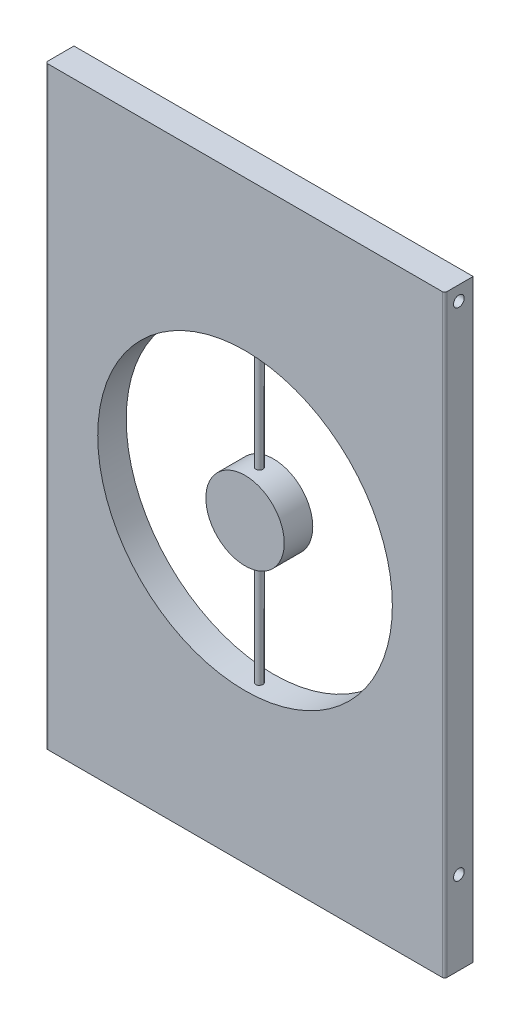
SolidWorks part; units mm, degrees
ref_plane "Front Plane" through (0, 0, 0) normal (0, 0, 1) x (1, 0, 0)
ref_plane "Top Plane" through (0, 0, 0) normal (0, 1, 0) x (1, 0, 0)
ref_plane "Right Plane" through (0, 0, 0) normal (1, 0, 0) x (0, 0, -1)
body saved out of another part "Stock-Donut Shop-1"
hole_wizard "CBORE for M4 Pan Head Machine Screw3" positions "Sketch4" profile "Sketch5" counterbore size "M4" standard "ANSI Metric"
sketch "Sketch4" plane through (48, 0, 0) normal (-1, 0, 0) x (0, 0, 1)
  point P0 (-81, 256)
  point P3 (99, 256)
sketch "Sketch5" plane through (48, 256, -81) normal (0, 1, 0) x (0, 0, 1)
  line L0 (0, 0) -> (0, 30)
  line L1 (0, 30) -> (2.25, 28.6481)
  line L2 (2.25, 28.6481) -> (2.25, 3.1)
  line L3 (2.25, 3.1) -> (4.5, 3.1)
  line L4 (4.5, 3.1) -> (4.5, 0)
  line L5 (4.5, 0) -> (0, 0)
  line L6 (0, 30) -> (-2.25, 28.6481) construction
  line L7 (0, -6.35) -> (0, 107.95) construction
  dimension "Hole Dia." = 4.5
  dimension "Hole Depth" = 30
  dimension "C'Bore Dia." = 9
  dimension "C'Bore Depth" = 3.1
  dimension "Drill Angle" = 118
hole_wizard "CBORE for M4 Pan Head Machine Screw4" positions "3DSketch2" profile "Sketch6" counterbore size "M4" standard "ANSI Metric"
sketch3d "3DSketch2"
  point P0 (240, 256, 99)
  point P3 (240, 256, -81)
  point P6 (240, 47, 99)
  point P9 (240, 6, 99)
  point P12 (240, 6, -99)
sketch "Sketch6" plane through (240, 256, 99) normal (0, 1, 0) x (0, 0, -1)
  line L0 (0, 0) -> (0, 30)
  line L1 (0, 30) -> (2.25, 28.6481)
  line L2 (2.25, 28.6481) -> (2.25, 3.1)
  line L3 (2.25, 3.1) -> (4.5, 3.1)
  line L4 (4.5, 3.1) -> (4.5, 0)
  line L5 (4.5, 0) -> (0, 0)
  line L6 (0, 30) -> (-2.25, 28.6481) construction
  line L7 (0, -6.35) -> (0, 107.95) construction
  dimension "Hole Dia." = 4.5
  dimension "Hole Depth" = 30
  dimension "C'Bore Dia." = 9
  dimension "C'Bore Depth" = 3.1
  dimension "Drill Angle" = 118
ref_plane "Plane1" through (0, 0, 99) normal (0, 0, 1) x (1, 0, 0)
sketch "Sketch7" plane through (0, 0, 99) normal (0, 0, 1) x (1, 0, 0)
  point P0 (144, 137)
fillet "Fillet1" radius 1 2 edges at (60, 137, 105) (228, 137, 105)
